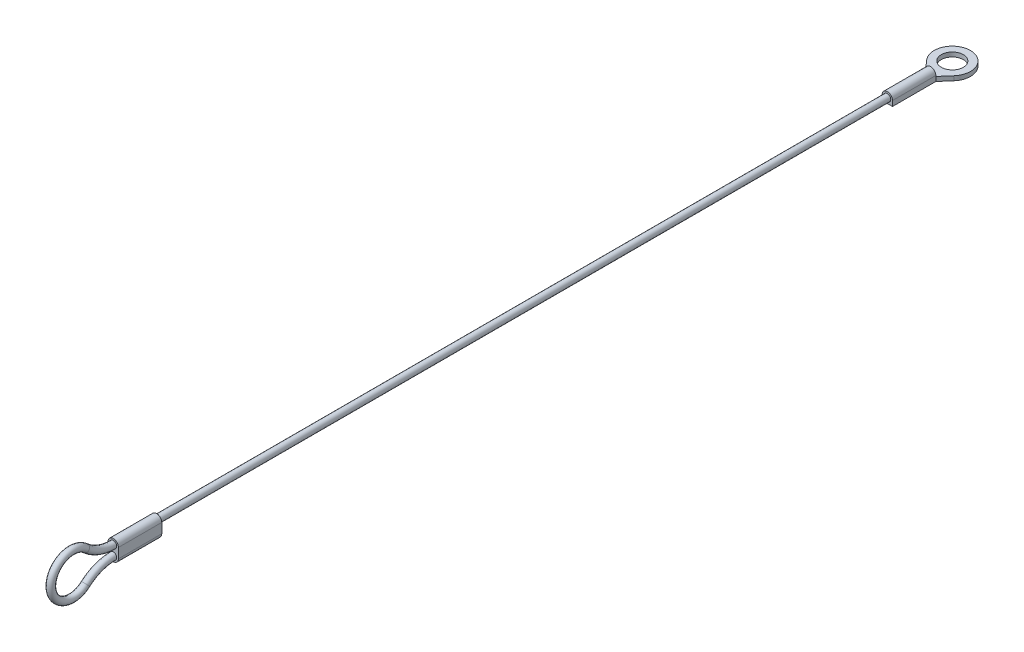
SolidWorks part; units mm, degrees
ref_plane "Front Plane" through (0, 0, 0) normal (0, 0, 1) x (1, 0, 0)
ref_plane "Top Plane" through (0, 0, 0) normal (0, 1, 0) x (1, 0, 0)
ref_plane "Right Plane" through (0, 0, 0) normal (1, 0, 0) x (0, 0, -1)
sketch "Sketch1" plane through (0, 0, 0) normal (1, 0, 0) x (0, 0, -1)
  line L2 (-178.6, 0) -> (0, 0)
  arc A0 (-178.6, 0) -> (-185, 2.4446) centre (-178.6, 9.6) cw
  arc A1 (-185, 2.4446) -> (-185, -4.7108) centre (-188.2, -1.1331) ccw
  arc A2 (-185, -4.7108) -> (-178.6, -2.2663) centre (-178.6, -11.8663) cw
  dimension "D1" = 4.8
  dimension "D4" = 9.6
  dimension "D2" = 188.2
  dimension "D3" = 9.6
sketch "Sketch2" plane through (0, 0, 0) normal (0, 0, 1) x (1, 0, 0)
  circle A0 centre (0, 0) radius 0.795
  dimension "D1" = 1.59
sweep "Sweep1" add profiles "Sketch2" path "Sketch1"
sketch "Sketch3" plane through (0, 0, 178.6) normal (0, 0, -1) x (-1, 0, 0)
  line L0 (0, 0) -> (0, -2.2663) construction
  line L1 (1.195, 0) -> (1.195, -2.2663)
  line L2 (-1.195, 0) -> (-1.195, -2.2663)
  line L3 (-0.795, -2.2663) -> (0.795, -2.2663) construction
  arc A0 (1.195, 0) -> (-1.195, 0) centre (0, 0) ccw
  arc A1 (-1.195, -2.2663) -> (1.195, -2.2663) centre (0, -2.2663) ccw
  point P3 (0, -1.1331)
  dimension "D1" = 2.39
extrude "Boss-Extrude1" add sketch "Sketch3" along normal blind 10
sketch "Sketch4" plane through (0, 0, 0) normal (0, 0, -1) x (-1, 0, 0)
  line L0 (-1.195, 0) -> (-1.195, -1.195)
  line L1 (-1.195, -1.195) -> (0, -1.195)
  line L2 (0, -1.195) -> (1.195, -1.195)
  line L3 (1.195, -1.195) -> (1.195, 0)
  arc A0 (1.195, 0) -> (-1.195, 0) centre (0, 0) ccw
  dimension "D1" = 2.39
extrude "Boss-Extrude2" add sketch "Sketch4" along normal blind 10
sketch "Sketch5" plane through (0, -1.195, 0) normal (0, -1, 0) x (1, 0, 0)
  line L0 (-1.195, -10) -> (1.195, -10)
  line L1 (1.195, -10) -> (3.155, -12.2428)
  line L2 (-3.155, -12.2428) -> (-1.195, -10)
  arc A0 (3.155, -12.2428) -> (-3.155, -12.2428) centre (0, -15) cw
  circle A1 centre (0, -15) radius 2.54
  point P8 (-4.19, -15)
  point P9 (4.19, -15)
  dimension "D1" = 5.08
  dimension "D2" = 8.38
  dimension "D3" = 15
extrude "Boss-Extrude3" add sketch "Sketch5" against normal blind 1.01
